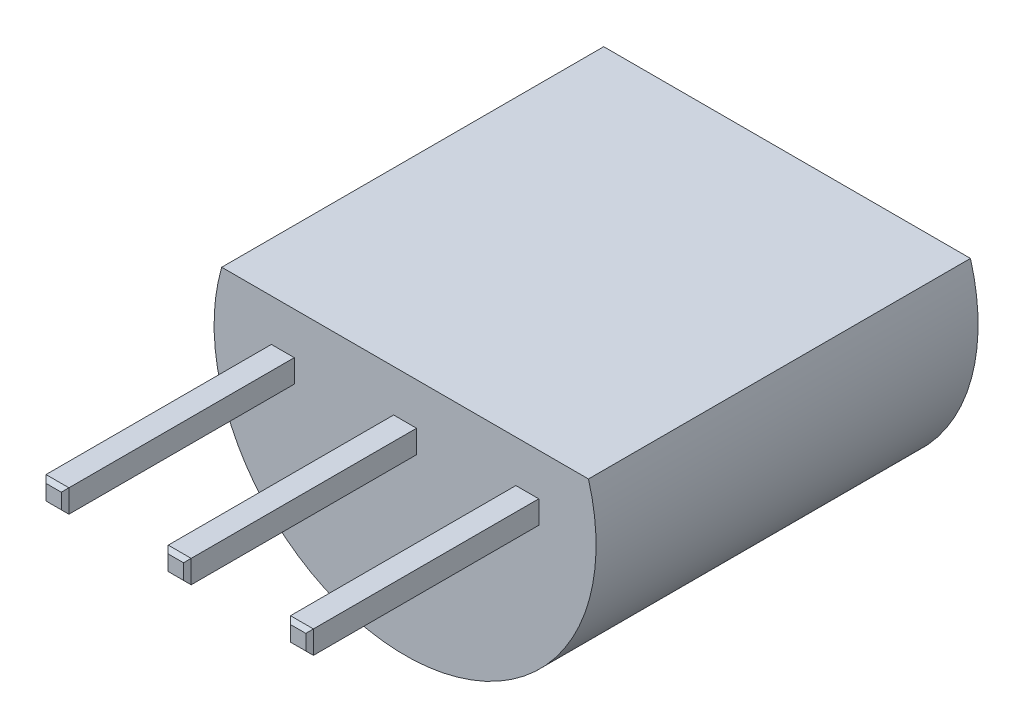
SolidWorks part; units mm, degrees
ref_plane "Plan de face" through (0, 0, 0) normal (0, 0, 1) x (1, 0, 0)
ref_plane "Plan de dessus" through (0, 0, 0) normal (0, 1, 0) x (1, 0, 0)
ref_plane "Plan de droite" through (0, 0, 0) normal (1, 0, 0) x (0, 0, -1)
sketch "Esquisse2" plane through (0, 0, 0) normal (0, 0, 1) x (1, 0, 0)
  circle A0 centre (0, 0) radius 2.5 construction
  circle A3 centre (0, 0) radius 2.5
extrude "Extrusion1" add sketch "Esquisse2" against normal blind 5
sketch "Esquisse5" plane through (0, 0, 0) normal (0, 0, 1) x (1, 0, 0)
  line L0 (0, 1.0031) -> (0, -1.0758) construction
  line L1 (-1.45, 0.15) -> (-1.75, 0.15)
  line L2 (-1.45, 0.15) -> (-1.45, -0.15)
  line L3 (-1.45, -0.15) -> (-1.75, -0.15)
  line L4 (-1.75, 0.15) -> (-1.75, -0.15)
  line L5 (1.45, 0.15) -> (1.45, -0.15)
  line L6 (1.45, 0.15) -> (1.75, 0.15)
  line L7 (1.75, 0.15) -> (1.75, -0.15)
  line L8 (1.45, -0.15) -> (1.75, -0.15)
  line L10 (-0.15, 0.15) -> (0.15, 0.15)
  line L11 (-0.15, 0.15) -> (-0.15, -0.15)
  line L12 (-0.15, -0.15) -> (0.15, -0.15)
  line L13 (0.15, 0.15) -> (0.15, -0.15)
  dimension "D1" = 1.75
  dimension "D2" = 0.15
  dimension "D3" = 0.15
  dimension "D4" = 1.45
  dimension "D5" = 0.15
extrude "Extrusion3" add sketch "Esquisse5" along normal blind 3
chamfer "Chanfrein1" distance 0.05 angle 45 12 edges at (1.45, 0, 3) (1.6, -0.15, 3) (1.75, 0, 3) (1.6, 0.15, 3) (-1.75, 0, 3) (-1.6, -0.15, 3) (-1.45, 0, 3) (-1.6, 0.15, 3) (0, 0.15, 3) (0.15, 0, 3) (0, -0.15, 3) (-0.15, 0, 3)
sketch "Esquisse6" plane through (0, 0, -5) normal (0, 0, -1) x (-1, 0, 0)
  line L1 (-2.828, 2.932) -> (2.6837, 2.932)
  line L2 (-2.828, 2.932) -> (-2.828, 0.7)
  line L3 (-2.828, 0.7) -> (2.6837, 0.7)
  line L4 (2.6837, 2.932) -> (2.6837, 0.7)
  dimension "D1" = 0.7
extrude "Enlèv. mat.-Extru.2" cut sketch "Esquisse6" against normal through all
